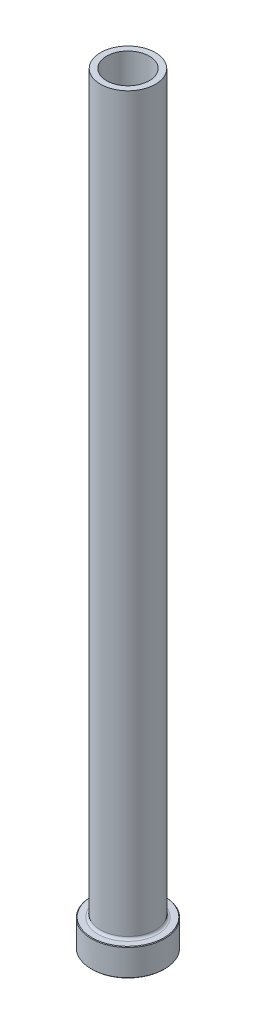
SolidWorks part; units mm, degrees
ref_plane "Front Plane" through (0, 0, 0) normal (0, 0, 1) x (1, 0, 0)
ref_plane "Top Plane" through (0, 0, 0) normal (0, 1, 0) x (1, 0, 0)
ref_plane "Right Plane" through (0, 0, 0) normal (1, 0, 0) x (0, 0, -1)
sketch "Sketch1" plane through (0, 0, 0) normal (0, 0, 1) x (1, 0, 0)
  line L0 (-7, 250) -> (-9, 250)
  line L1 (-9, 250) -> (-9, 9)
  line L2 (-9, 9) -> (-12, 9)
  line L3 (-12, 9) -> (-12, 0)
  line L4 (13.2, 0) -> (-13.2, 0) construction
  line L5 (-12, 0) -> (-7.25, 0)
  line L6 (-7, 195) -> (-7, 250)
  line L7 (0, 92.1877) -> (0, -15.5353) construction
  line L8 (0, -13.2) -> (0, 13.2) construction
  line L9 (-7, 195) -> (-7.25, 183)
  line L10 (-7.25, 183) -> (-7.25, 0)
  dimension "D1" = 0.25
  dimension "ID" = 14
  dimension "OD" = 18
  dimension "L" = 250
  dimension "H" = 24
  dimension "T" = 9
  dimension "N" = 55
  dimension "D2" = 12
revolve "Revolve1" add sketch "Sketch1" angle 360 about L7
fillet "Fillet1" radius 0.8 1 edges at (0, 9, 9)
chamfer "Chamfer1" distance 0.2 angle 45 2 edges at (0, 9, 12) (0, 0, 12)
chamfer "Chamfer3" distance 0.5 angle 45 1 edges at (0, 0, 7.25)
